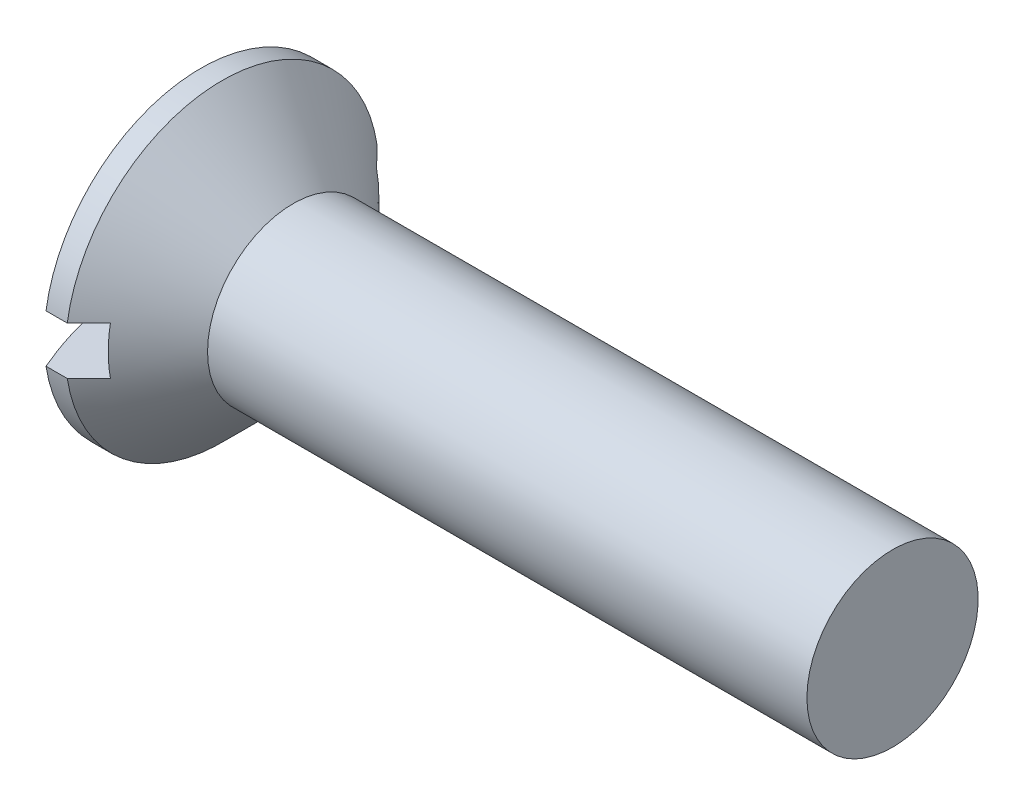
SolidWorks part; units mm, degrees
ref_plane "Plane1" through (0, 0, 0) normal (0, 0, 1) x (1, 0, 0)
ref_plane "Plane2" through (0, 0, 0) normal (0, 1, 0) x (1, 0, 0)
ref_plane "Plane3" through (0, 0, 0) normal (1, 0, 0) x (0, 0, -1)
sketch "BodySke" plane through (0, 0, 0) normal (0, 0, 1) x (1, 0, 0)
  line L0 (0, 0) -> (42.2988, 0)
  line L1 (42.2988, 0) -> (42.2988, 5)
  line L2 (42.2988, 5) -> (7.2988, 5)
  line L3 (7.2988, 5) -> (-0.5742, 12.873) construction
  line L4 (-15.875, 0) -> (82.55, 0) construction
  line L5 (7.2988, -5) -> (-0.5742, -12.873) construction
  line L6 (8.7988, 8.175) -> (8.7988, -7.7) construction
  line L7 (2.2988, 5.2375) -> (2.2988, -10.6375) construction
  line L8 (7.2988, 5) -> (3.1488, 9.15)
  line L9 (3.1488, 9.15) -> (1.9074, 9.15)
  arc A0 (0, 0) -> (1.9074, 9.15) centre (22.9, 0) cw
  arc A1 (2.2988, 10) -> (0, 0) centre (22.9, 0) ccw construction
  dimension "D3" = 20
  dimension "Crown_rad" = 22.9
  dimension "D4" = 2.2988
  dimension "Length" = 40
  dimension "Diameter" = 10
  dimension "Head_dia" = 18.3
  dimension "Head_ang" = 90
  dimension "Advance" = 1.5
  dimension "Thread_nom" = 40
  dimension "Side_ht" = 5
revolve "Base-Revolve" add sketch "BodySke" angle 360 about L4
sketch "Sketch2" plane through (0, 0, 0) normal (1, 0, 0) x (0, 0, -1)
  line L0 (9.15, -1.4) -> (-9.15, -1.4)
  line L1 (9.15, -1.4) -> (9.15, 1.4)
  line L2 (-9.15, 1.4) -> (9.15, 1.4)
  line L3 (-9.15, 1.4) -> (-9.15, -1.4)
  dimension "D1" = 18.3
  dimension "Slot_width" = 2.8
  dimension "D3" = 9.15
  dimension "D4" = 1.4
extrude "Slot" cut sketch "Sketch2" along normal blind 4.4
sketch "Sketch3" plane through (0, 0, 0) normal (1, 0, 0) x (0, 0, -1)
  line L0 (1.085, -5.62) -> (-1.085, -5.62)
  line L1 (1.085, -5.62) -> (1.085, 5.62)
  line L2 (-1.085, 5.62) -> (1.085, 5.62)
  line L3 (-1.085, 5.62) -> (-1.085, -5.62)
  dimension "D1" = 1.085
  dimension "Cross_width" = 2.17
  dimension "D2" = 5.62
  dimension "Cross_dia" = 11.24
ref_plane "Plane4" through (7.15, 0, 0) normal (1, 0, 0) x (0, 0, -1)
sketch "Sketch4" plane through (7.15, 0, 0) normal (1, 0, 0) x (0, 0, -1)
  line L0 (0.5425, -0.5425) -> (-0.5425, -0.5425)
  line L1 (0.5425, -0.5425) -> (0.5425, 0.5425)
  line L2 (-0.5425, 0.5425) -> (0.5425, 0.5425)
  line L3 (-0.5425, 0.5425) -> (-0.5425, -0.5425)
  dimension "D1" = 1.085
  dimension "D2" = 1.085
  dimension "D3" = 0.5425
  dimension "D4" = 0.5425
loft "Cross" cut profiles "Sketch3", "Sketch4"
pattern_circular "CirPattern1" count 2 every 90 about axis through (0, 0, 0) along (1, 0, 0) of "Cross"
sketch "ThdSchSke" plane through (0, 0, 0) normal (0, 0, 1) x (1, 0, 0)
  line L0 (8.7988, -4.172) -> (8.219, -5)
  line L1 (8.7988, -4.172) -> (9.3786, -5)
  line L2 (9.3786, -5) -> (9.3786, -6.25)
  line L3 (-3.175, 0) -> (5.1513, 0) construction
  line L5 (9.3786, -6.25) -> (8.219, -6.25)
  line L6 (8.219, -6.25) -> (8.219, -5)
  line L8 (42.2988, -5) -> (42.2988, 5) construction
  dimension "Thread_minor" = 8.344
  dimension "Diameter" = 10
  dimension "Start" = 33.5
  dimension "SideAngle" = 55
  dimension "VeeAngle" = 70
  dimension "Overcut" = 12.5
revolve "ThreadSchematic" [suppressed] cut sketch "ThdSchSke" angle 360 about L3
pattern_linear "ThdSchPat" [suppressed]
equation "\"D1@Sketch2\" = \"Head_dia@BodySke\""
equation "\"D3@Sketch2\" = \"D1@Sketch2\" / 2"
equation "\"D4@Sketch2\" = \"Slot_width@Sketch2\" / 2"
equation "\"D1@Sketch3\" = \"Cross_width@Sketch3\" / 2"
equation "\"D2@Sketch3\" = \"Cross_dia@Sketch3\" / 2"
equation "\"D1@Sketch4\" = \"Cross_width@Sketch3\"*.5"
equation "\"D2@Sketch4\" = \"D1@Sketch4\""
equation "\"D3@Sketch4\" = \"D1@Sketch4\" / 2"
equation "\"D4@Sketch4\" = \"D2@Sketch4\" / 2"
equation "\"Thread_length@ThreadCosmetic\" = ((sgn( (\"Length@BodySke\" - \"Advance@BodySke\" - \"Side_ht@BodySke\" ) - \"Thread_nom@BodySke\" )-1)*( (\"Length@BodySke\" - \"Advance@BodySke\" - \"Side_ht@BodySke\" ) - \"Thread_"
equation "\"Thread_minor@ThdSchSke\" = \"Thread_minor@ThreadCosmetic\""
equation "\"Diameter@ThdSchSke\" = \"Diameter@BodySke\""
equation "\"Overcut@ThdSchSke\" = \"Diameter@BodySke\" * 1.25"
equation "\"Start@ThdSchSke\" =  \"Thread_length@ThreadCosmetic\""
equation "\"Num_threads@ThdSchPat\" = int( \"Thread_length@ThreadCosmetic\" / \"Advance@BodySke\" + 0.999 )  + 1"
equation "\"Advance@ThdSchPat\" = \"Thread_length@ThreadCosmetic\" /  (\"Num_threads@ThdSchPat\" - 1) 'relax it"
